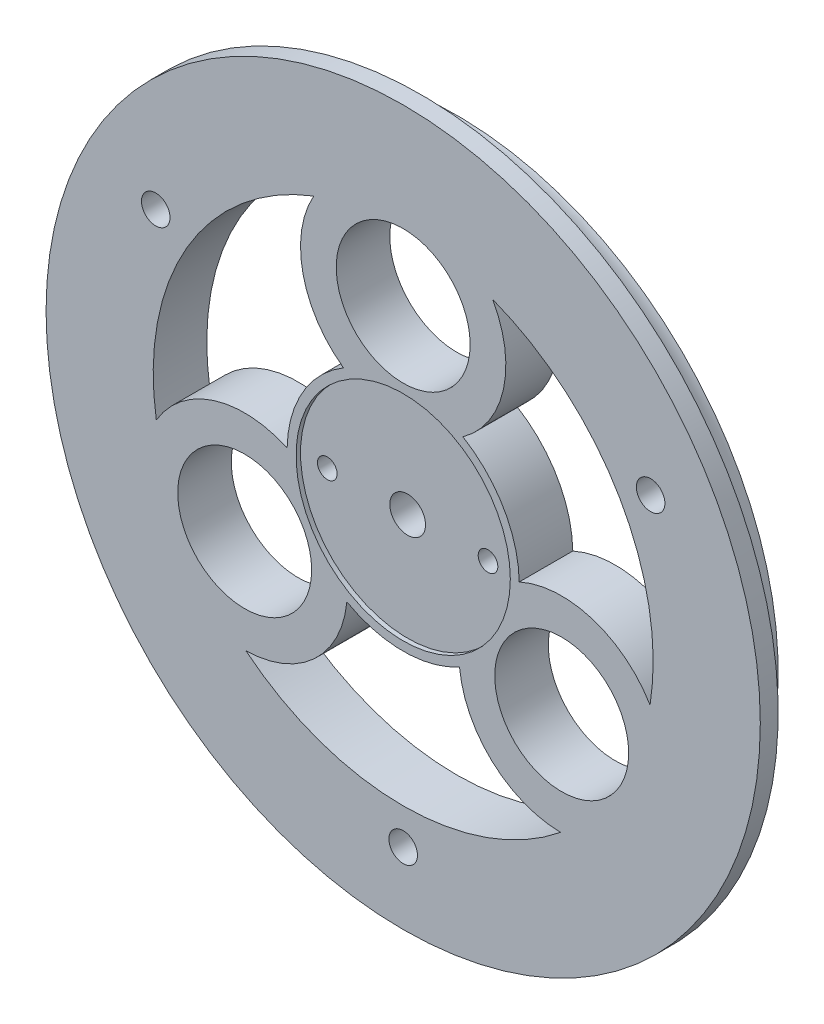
SolidWorks part; units mm, degrees
ref_plane "Plan de face" through (0, 0, 0) normal (0, 0, 1) x (1, 0, 0)
ref_plane "Plan de dessus" through (0, 0, 0) normal (0, 1, 0) x (1, 0, 0)
ref_plane "Plan de droite" through (0, 0, 0) normal (1, 0, 0) x (0, 0, -1)
sketch "Esquisse1" plane through (0, 0, 0) normal (0, 0, 1) x (1, 0, 0)
  line L0 (-92.4278, 0) -> (45.3907, 0) construction
  line L1 (0, 44.6852) -> (0, -91.2519) construction
  line L2 (9, 5.3287) -> (9, -2.1074) construction
  line L4 (0, 0) -> (-45.7689, 26.4247) construction
  circle A0 centre (0, 0) radius 40
  circle A1 centre (9, 0) radius 1.1
  arc A2 (27.6526, -4.397) -> (10.0184, 26.1463) centre (0, 0) ccw
  circle A3 centre (0, 0) radius 32 construction
  circle A4 centre (0, 0) radius 2
  arc A5 (12.9981, 0.2207) -> (6.6902, 11.1463) centre (0, 0) ccw
  circle A6 centre (-27.7128, 16) radius 1.6
  circle A7 centre (0, 0) radius 12 construction
  circle A8 centre (0, 0) radius 20.5 construction
  circle A9 centre (27.7128, 16) radius 1.6
  circle A10 centre (0, 20.5) radius 7.5
  circle A11 centre (0, -32) radius 1.6
  arc A12 (-10.0184, 26.1463) -> (-6.6902, 11.1463) centre (0, 20.5) ccw
  circle A13 centre (17.7535, -10.25) radius 7.5
  arc A14 (27.6526, -4.397) -> (12.9981, 0.2207) centre (17.7535, -10.25) ccw
  circle A15 centre (-17.7535, -10.25) radius 7.5
  arc A16 (-17.6342, -21.7494) -> (-6.3079, -11.3671) centre (-17.7535, -10.25) ccw
  arc A17 (6.3079, -11.3671) -> (17.6342, -21.7494) centre (17.7535, -10.25) ccw
  arc A18 (-17.6342, -21.7494) -> (17.6342, -21.7494) centre (0, 0) ccw
  arc A19 (-12.9981, 0.2207) -> (-27.6526, -4.397) centre (-17.7535, -10.25) ccw
  arc A20 (-6.3079, -11.3671) -> (6.3079, -11.3671) centre (0, 0) ccw
  arc A21 (-10.0184, 26.1463) -> (-27.6526, -4.397) centre (0, 0) ccw
  arc A22 (6.6902, 11.1463) -> (10.0184, 26.1463) centre (0, 20.5) ccw
  circle A23 centre (-17.7535, -10.25) radius 9.5
  circle A24 centre (0, 20.5) radius 9.5
  circle A25 centre (17.7535, -10.25) radius 9.5
  arc A26 (-6.6902, 11.1463) -> (-12.9981, 0.2207) centre (0, 0) ccw
  circle A27 centre (-9, 0) radius 1.1
  dimension "D1" = 9
  dimension "D3" = 60
extrude "Extrusion1" add sketch "Esquisse1" along normal blind 6
sketch "Esquisse2" plane through (0, 0, 0) normal (0, 0, -1) x (-1, 0, 0)
  circle A0 centre (0, 0) radius 36
  circle A1 centre (0, 0) radius 41
extrude "Enlèv. mat.-Extru.1" cut sketch "Esquisse2" against normal blind 4
fillet "Congé1" radius 4 1 edges at (-36, 0, 4)
sketch "Esquisse3" plane through (0, 0, 6) normal (0, 0, 1) x (1, 0, 0)
  circle A0 centre (0, 0) radius 12
extrude "Enlèv. mat.-Extru.2" cut sketch "Esquisse3" against normal blind 0.5
